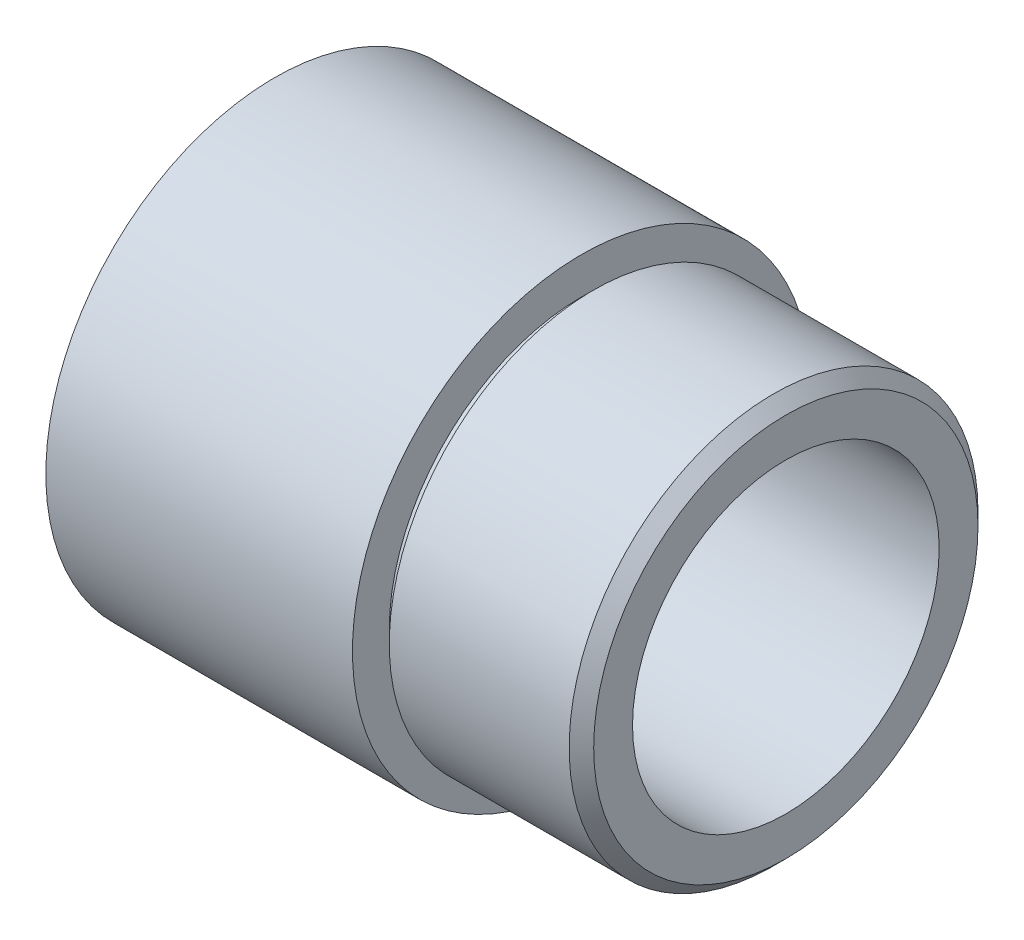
SolidWorks part; units mm, degrees
ref_plane "Front" through (0, 0, 0) normal (0, 0, 1) x (1, 0, 0)
ref_plane "Top" through (0, 0, 0) normal (0, 1, 0) x (1, 0, 0)
ref_plane "Right" through (0, 0, 0) normal (1, 0, 0) x (0, 0, -1)
sketch "Sketch1" plane through (0, 0, 0) normal (0, 0, 1) x (1, 0, 0)
  line L0 (0, 0) -> (-46.7931, 0) construction
  line L1 (-149.3524, -9.525) -> (765.0476, -9.525) construction
  line L2 (291.9726, -14.224) -> (311.0226, -14.224)
  line L3 (-117.6024, -12.7) -> (-149.3524, -12.7) construction
  line L4 (311.0226, -14.224) -> (311.0226, -12.7)
  line L5 (311.0226, -12.7) -> (323.7226, -12.7)
  line L6 (323.7226, -12.7) -> (323.7226, -9.525)
  line L8 (323.7226, -9.525) -> (291.9726, -9.525)
  line L9 (291.9726, -9.525) -> (291.9726, -14.224)
  line L11 (-149.3524, -14.224) -> (-130.3024, -14.224) construction
  line L14 (-117.6024, -9.525) -> (-117.6024, -12.7) construction
  line L15 (-130.3024, -12.7) -> (-117.6024, -12.7) construction
revolve "Base-Revolve" add sketch "Sketch1" angle 360 about L0
sketch "Sketch2" plane through (0, 0, 0) normal (0, 0, 1) x (1, 0, 0)
  line L0 (0, 0) -> (-32.8597, 0) construction
  line L1 (0, 0) -> (-46.7931, 0) construction
  line L2 (322.9606, 12.7) -> (323.7226, 12.7)
  line L3 (323.7226, -12.7) -> (323.7226, 12.7) construction
  line L4 (323.7226, 12.7) -> (323.7226, 11.938)
  line L5 (323.7226, 11.938) -> (322.9606, 12.7)
  line L6 (311.0226, -14.224) -> (311.0226, 14.224) construction
  line L7 (311.7846, 12.7) -> (311.0226, 12.7)
  line L8 (311.7846, 12.7) -> (311.7846, 11.938)
  line L9 (311.7846, 11.938) -> (311.0226, 11.938)
  line L10 (311.0226, 12.7) -> (311.0226, 11.938)
  line L11 (323.7226, 12.7) -> (311.0226, 12.7) construction
  dimension "D1" = 0.762
revolve "Cut-Revolve1" cut sketch "Sketch2" angle 360 about L0
